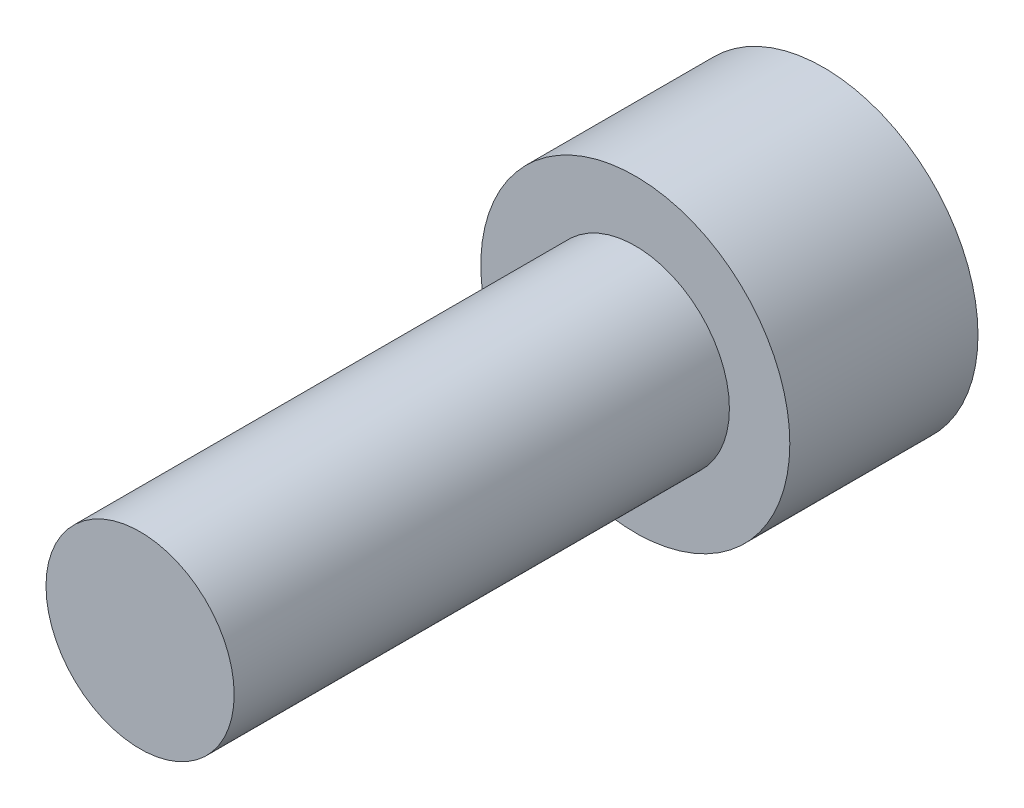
SolidWorks part; units mm, degrees
ref_plane "Front Plane" through (0, 0, 0) normal (0, 0, 1) x (1, 0, 0)
ref_plane "Top Plane" through (0, 0, 0) normal (0, 1, 0) x (1, 0, 0)
ref_plane "Right Plane" through (0, 0, 0) normal (1, 0, 0) x (0, 0, -1)
sketch "Sketch6" plane through (0, 0, 0) normal (1, 0, 0) x (0, 0, -1)
  line L0 (-12.7, 0) -> (22.525, 0) construction
  line L1 (4.3586, 0) -> (-4.3586, 0) construction
  line L2 (-12.7, 0) -> (-12.7, -2.413)
  line L3 (-12.7, -2.413) -> (0, -2.413)
  line L4 (0, 4.3586) -> (0, -4.3586) construction
  line L5 (0, -2.413) -> (0, -3.9624)
  line L6 (0, -3.9624) -> (4.826, -3.9624)
  line L7 (4.826, -3.9624) -> (4.826, 0)
  line L8 (4.826, 0) -> (-12.7, 0)
  dimension "L" = 12.7
  dimension "H" = 4.826
  dimension "A" = 7.9248
  dimension "D" = 4.826
revolve "Revolve1" add sketch "Sketch6" angle 360 about L0
sketch "Sketch7" plane through (0, 0, -4.826) normal (0, 0, -1) x (-1, 0, 0)
  line L2 (-1.9812, 1.1438) -> (-1.9812, -1.1438)
  line L4 (-1.9812, -1.1438) -> (0, -2.2877)
  line L5 (0, -2.2877) -> (1.9812, -1.1438)
  line L6 (1.9812, -1.1438) -> (1.9812, 1.1438)
  line L7 (1.9812, 1.1438) -> (0, 2.2877)
  line L8 (0, 2.2877) -> (-1.9812, 1.1438)
  circle A0 centre (0, 0) radius 1.9812 construction
  dimension "J" = 3.9624
extrude "HEX" cut sketch "Sketch7" against normal blind 3.048
